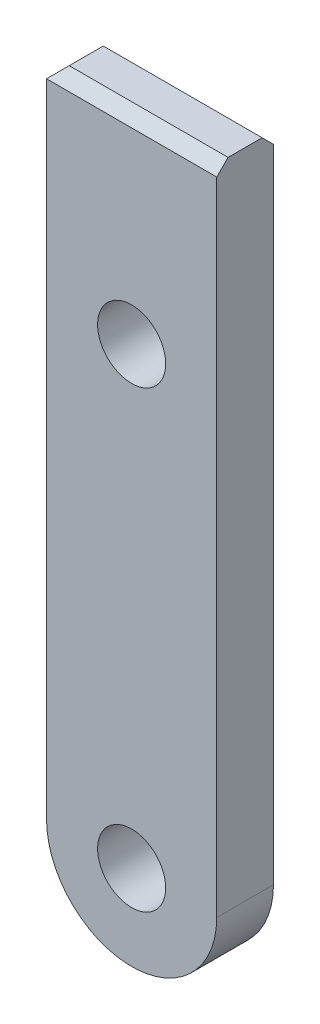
SolidWorks part; units mm, degrees
ref_plane "Face" through (0, 0, 0) normal (0, 0, 1) x (1, 0, 0)
ref_plane "Dessus" through (0, 0, 0) normal (0, 1, 0) x (1, 0, 0)
ref_plane "Droite" through (0, 0, 0) normal (1, 0, 0) x (0, 0, -1)
sketch "Esquisse1" plane through (0, 0, 0) normal (0, 0, 1) x (1, 0, 0)
  line L1 (0, 0) -> (30, 0)
  line L2 (0, 0) -> (0, -115)
  line L4 (30, 0) -> (30, -115)
  arc A0 (0, -115) -> (30, -115) centre (15, -115) ccw
  dimension "D1" = 30
extrude "Extrusion1" add sketch "Esquisse1" along normal blind 10
sketch "Esquisse2" plane through (0, 0, 10) normal (0, 0, 1) x (1, 0, 0)
  circle A0 centre (15, -115) radius 6
  circle A1 centre (15, -35) radius 6
  dimension "D1" = 12
  dimension "D2" = 80
extrude "Enlèv. mat.-Extru.1" cut sketch "Esquisse2" against normal blind 10
chamfer "Chanfrein1" distance 2 angle 45 2 edges at (15, 0, 10) (15, 0, 0)
chamfer "Chanfrein2" distance 2 angle 45 1 edges at (0, 0, 5)
